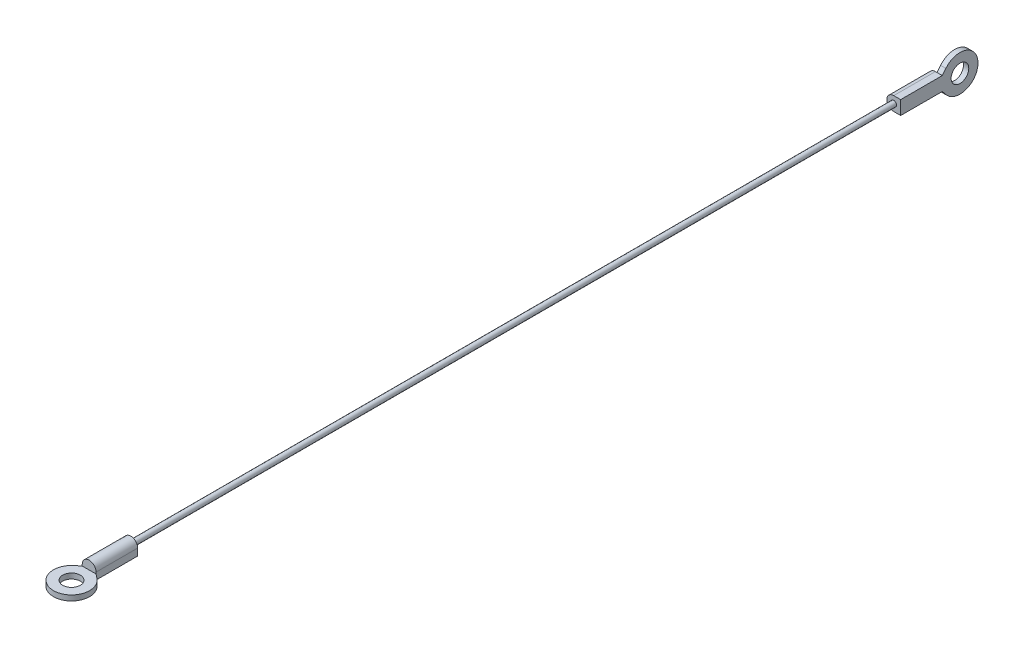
SolidWorks part; units mm, degrees
ref_plane "Front Plane" through (0, 0, 0) normal (0, 0, 1) x (1, 0, 0)
ref_plane "Top Plane" through (0, 0, 0) normal (0, 1, 0) x (1, 0, 0)
ref_plane "Right Plane" through (0, 0, 0) normal (1, 0, 0) x (0, 0, -1)
sketch "Sketch1" plane through (0, 0, 0) normal (0, 0, 1) x (1, 0, 0)
  circle A0 centre (0, 0) radius 0.795
extrude "Boss-Extrude1" add sketch "Sketch1" along normal mid plane 219.84
sketch "Sketch2" plane through (0, 0, 109.92) normal (0, 0, 1) x (1, 0, 0)
  line L0 (-1.99, 0) -> (-1.99, -1.99)
  line L1 (-1.99, -1.99) -> (0, -1.99)
  line L2 (0, -1.99) -> (1.99, -1.99)
  line L3 (1.99, -1.99) -> (1.99, 0)
  arc A0 (1.99, 0) -> (-1.99, 0) centre (0, 0) ccw
  dimension "D1" = 3.98
extrude "Boss-Extrude2" add sketch "Sketch2" along normal blind 12
sketch "Sketch3" plane through (0, -1.99, 0) normal (0, -1, 0) x (1, 0, 0)
  line L0 (1.99, 121.92) -> (3.2639, 122.9455)
  line L1 (-3.2639, 122.9455) -> (-1.99, 121.92)
  line L2 (-1.99, 121.92) -> (1.99, 121.92)
  arc A0 (3.2639, 122.9455) -> (-3.2639, 122.9455) centre (0, 127) ccw
  circle A1 centre (0, 127) radius 2.54
  point P8 (5.205, 127)
  point P9 (-5.205, 127)
  dimension "D1" = 5.08
  dimension "D2" = 10.41
  dimension "D3" = 127
extrude "Boss-Extrude3" add sketch "Sketch3" against normal blind 1.52
sketch "Sketch4" plane through (0, 0, -109.92) normal (0, 0, -1) x (-1, 0, 0)
  line L0 (0, 1.99) -> (-1.99, 1.99)
  line L1 (-1.99, 1.99) -> (-1.99, 0)
  line L2 (-1.99, 0) -> (-1.99, -1.99)
  line L3 (-1.99, -1.99) -> (0, -1.99)
  arc A0 (0, -1.99) -> (0, 1.99) centre (0, 0) ccw
  dimension "D1" = 3.98
extrude "Boss-Extrude4" add sketch "Sketch4" along normal blind 12
sketch "Sketch5" plane through (1.99, 0, 0) normal (1, 0, 0) x (0, 0, -1)
  line L0 (121.92, -1.99) -> (121.92, 1.99)
  line L1 (121.92, 1.99) -> (122.9455, 3.2639)
  line L2 (122.9455, -3.2639) -> (121.92, -1.99)
  arc A0 (122.9455, 3.2639) -> (122.9455, -3.2639) centre (127, 0) cw
  circle A1 centre (127, 0) radius 2.54
  point P8 (127, 5.205)
  point P9 (127, -5.205)
  dimension "D1" = 5.08
  dimension "D2" = 10.41
  dimension "D3" = 127
extrude "Boss-Extrude5" add sketch "Sketch5" against normal blind 1.52
